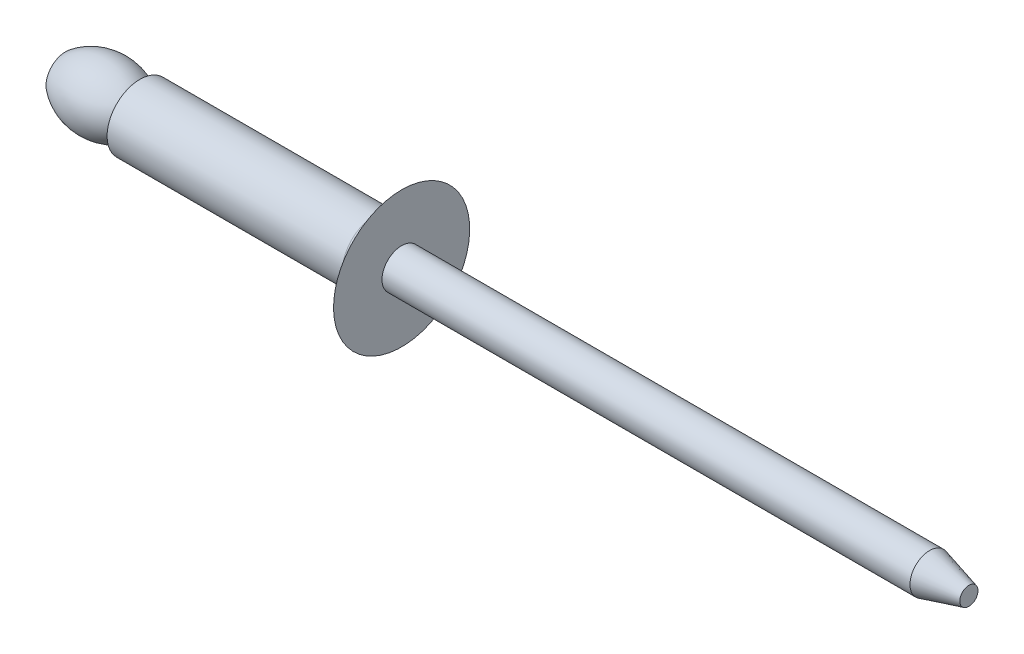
SolidWorks part; units mm, degrees
ref_plane "Front" through (0, 0, 0) normal (0, 0, 1) x (1, 0, 0)
ref_plane "Top" through (0, 0, 0) normal (0, 1, 0) x (1, 0, 0)
ref_plane "Right" through (0, 0, 0) normal (1, 0, 0) x (0, 0, -1)
sketch "Sketch1" plane through (-30.2384, 33.3584, 0) normal (0, 0, 1) x (0, -1, 0)
  line L0 (34.2584, 33.6384) -> (34.8584, 33.6384)
  line L1 (34.8584, 33.6384) -> (34.8584, 44.7031)
  line L2 (34.8584, 44.7031) -> (36.4784, 45.6384)
  line L3 (36.4784, 45.6384) -> (34.2584, 45.6384)
  line L4 (34.2584, 45.6384) -> (34.2584, 71.6384)
  line L5 (33.3584, 73.8835) -> (33.3584, -10.2868) construction
  line L6 (34.2584, 71.6384) -> (33.3584, 71.6384)
  line L7 (33.3584, 71.6384) -> (33.3584, 30.2384)
  line L8 (34.2584, 30.2384) -> (33.3584, 30.2384)
  arc A0 (34.2584, 33.6384) -> (34.2584, 30.2384) centre (32.15, 31.9384) cw
revolve "Base-Revolve" add sketch "Sketch1" angle 360 about L5
fillet "Fillet1" radius 0.5 1 edges at (14.4647, 1.5, 0)
chamfer "Chamfer1" distance 1.8 angle 15 1 edges at (41.4, 0.9, 0)
equation "\"D1@Chamfer1\" = \"d1@Sketch1\""
